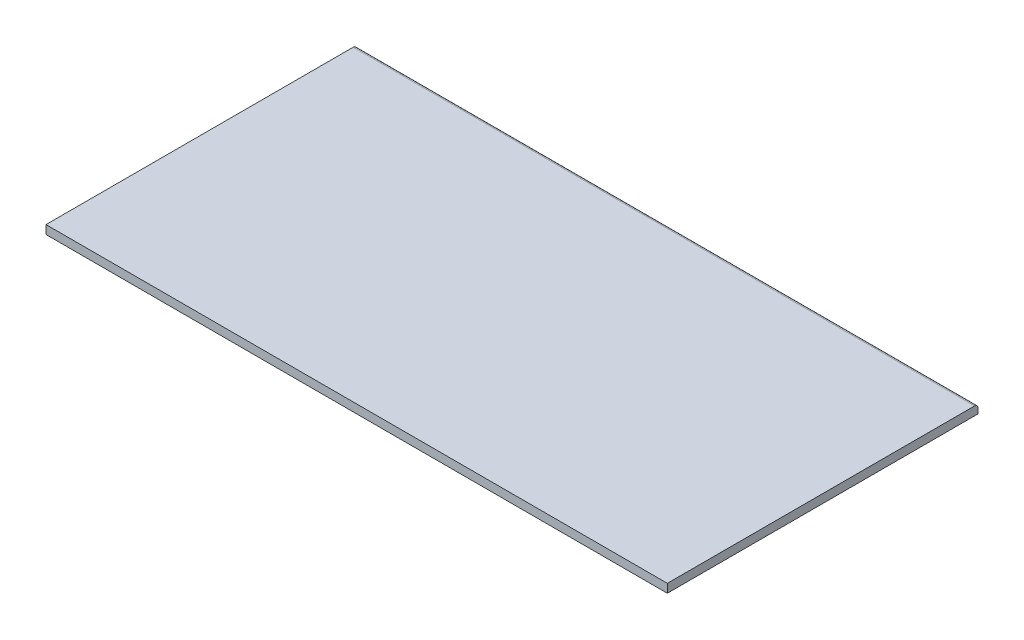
SolidWorks part; units mm, degrees
ref_plane "Front Plane" through (0, 0, 0) normal (0, 0, 1) x (1, 0, 0)
ref_plane "Top Plane" through (0, 0, 0) normal (0, 1, 0) x (1, 0, 0)
ref_plane "Right Plane" through (0, 0, 0) normal (1, 0, 0) x (0, 0, -1)
sketch "Sketch1" plane through (0, 0, 0) normal (0, 1, 0) x (1, 0, 0)
  line L0 (457.2, 228.6) -> (-457.2, -228.6) construction
  line L1 (-457.2, 228.6) -> (457.2, 228.6)
  line L2 (-457.2, 228.6) -> (-457.2, -228.6)
  line L3 (-457.2, -228.6) -> (457.2, -228.6)
  line L4 (457.2, 228.6) -> (457.2, -228.6)
  point P5 (0, 0)
  dimension "D1" = 914.4
  dimension "D2" = 457.2
extrude "Extrude1" add sketch "Sketch1" against normal blind 12.7
fillet "Fillet1" radius 5.08 1 edges at (0, 0, -228.6)
